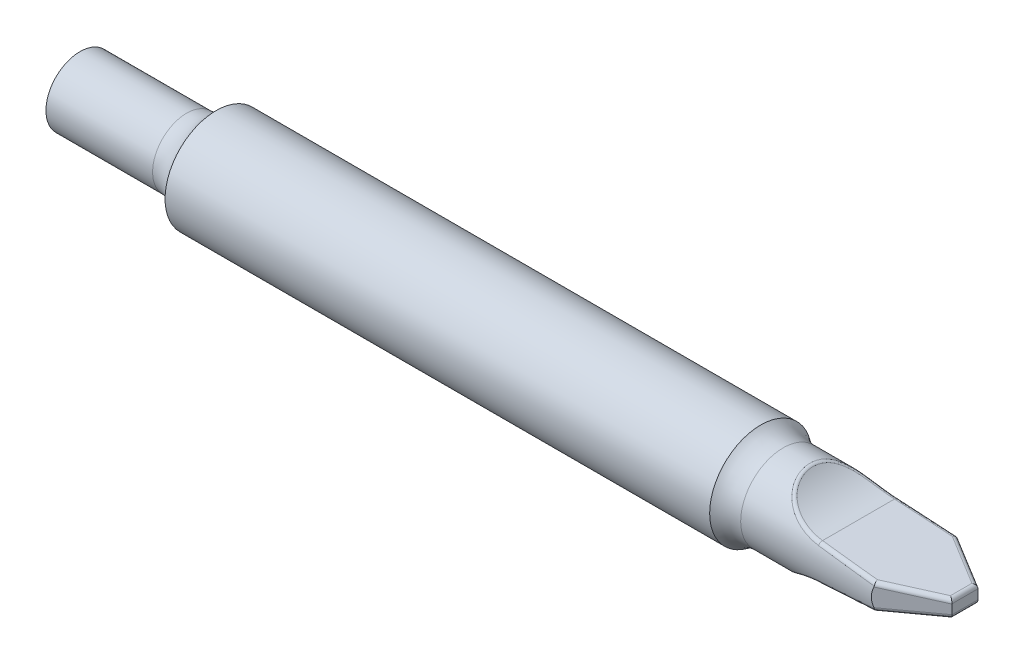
SolidWorks part; units mm, degrees
ref_plane "front" through (0, 0, 0) normal (0, 0, 1) x (1, 0, 0)
ref_plane "top" through (0, 0, 0) normal (0, 1, 0) x (1, 0, 0)
ref_plane "side" through (0, 0, 0) normal (1, 0, 0) x (0, 0, -1)
sketch "Sketch1" plane through (0, 0, 0) normal (1, 0, 0) x (0, 0, -1)
  circle A0 centre (0, 0) radius 12.7
  dimension "D1" = 25.4
extrude "Base-Extrude" add sketch "Sketch1" along normal blind 50.8
sketch "Sketch2" plane through (50.8, 0, 0) normal (1, 0, 0) x (0, 0, -1)
  circle A0 centre (0, 0) radius 19.05
  dimension "D1" = 38.1
extrude "Boss-Extrude1" add sketch "Sketch2" along normal blind 203.2
sketch "Sketch3" plane through (254, 0, 0) normal (1, 0, 0) x (0, 0, -1)
  circle A0 centre (0, 0) radius 15.875
  dimension "D1" = 31.75
extrude "Boss-Extrude2" add sketch "Sketch3" along normal blind 76.2
fillet "Fillet1" radius 12.7 1 edges at (254, 0, -15.875)
fillet "Fillet2" radius 12.7 1 edges at (50.8, 0, -12.7)
sketch "Sketch4" plane through (0, 0, 0) normal (0, 0, 1) x (1, 0, 0)
  line L0 (337.6393, 0) -> (276.0461, 0) construction
  line L1 (254, 0) -> (50.8, 0) construction
  line L2 (290.501, 6.6482) -> (330.2, 3.175)
  line L3 (330.2, 15.875) -> (262.4003, 15.875) construction
  line L4 (330.2, 15.875) -> (330.2, -15.875) construction
  line L5 (330.2, 3.175) -> (330.2, 15.875)
  line L6 (330.2, 15.875) -> (273.05, 15.875)
  arc A0 (290.501, 6.6482) -> (273.05, 15.875) centre (292.7148, 31.9516) cw
  dimension "D4" = 25.4
  dimension "D1" = 3.175
  dimension "D2" = 57.15
  dimension "D3" = 5
extrude "Cut-Extrude1" cut sketch "Sketch4" against normal mid plane 76.2
mirror "Mirror1" about plane through (0, 0, 0) normal (0, 1, 0) of "Cut-Extrude1"
sketch "Sketch5" plane through (0, 0, 0) normal (0, 1, 0) x (1, 0, 0)
  line L0 (333.9192, 0) -> (286.7111, 0) construction
  line L1 (330.2, 0) -> (262.4003, 0) construction
  line L2 (311.15, 15.875) -> (330.2, 4.8765)
  line L3 (330.2, 15.875) -> (262.4003, 15.875) construction
  line L4 (330.2, 15.5543) -> (330.2, -15.5543) construction
  line L5 (311.15, 15.875) -> (330.2, 15.875)
  line L6 (330.2, 15.875) -> (330.2, 4.8765)
  dimension "D1" = 30
  dimension "D2" = 19.05
extrude "Cut-Extrude2" cut sketch "Sketch5" against normal mid plane 76.2
mirror "Mirror2" about plane through (0, 0, 0) normal (0, 0, 1) of "Cut-Extrude2"
fillet "Fillet3" radius 1.524 14 edges at (273.0543, 15.8697, -0.4098) (301.3142, 5.7022, -14.8156) (273.0543, -15.8697, -0.4098) (301.3142, -5.7022, -14.8156) (321.3001, -3.9536, -10.0149) (321.3001, 3.9536, -10.0149) (311.15, 0, -15.875) (330.2, -3.175, 0) (301.3142, -5.7022, 14.8156) (321.3001, -3.9536, 10.0149) (330.2, 3.175, 0) (301.3142, 5.7022, 14.8156) (321.3001, 3.9536, 10.0149) (311.15, 0, 15.875)
ref_plane "shoulder" through (50.8, 0, 0) normal (1, 0, 0) x (0, 0, -1)
ref_plane "shoulder1" through (254, 0, 0) normal (1, 0, 0) x (0, 0, -1)
